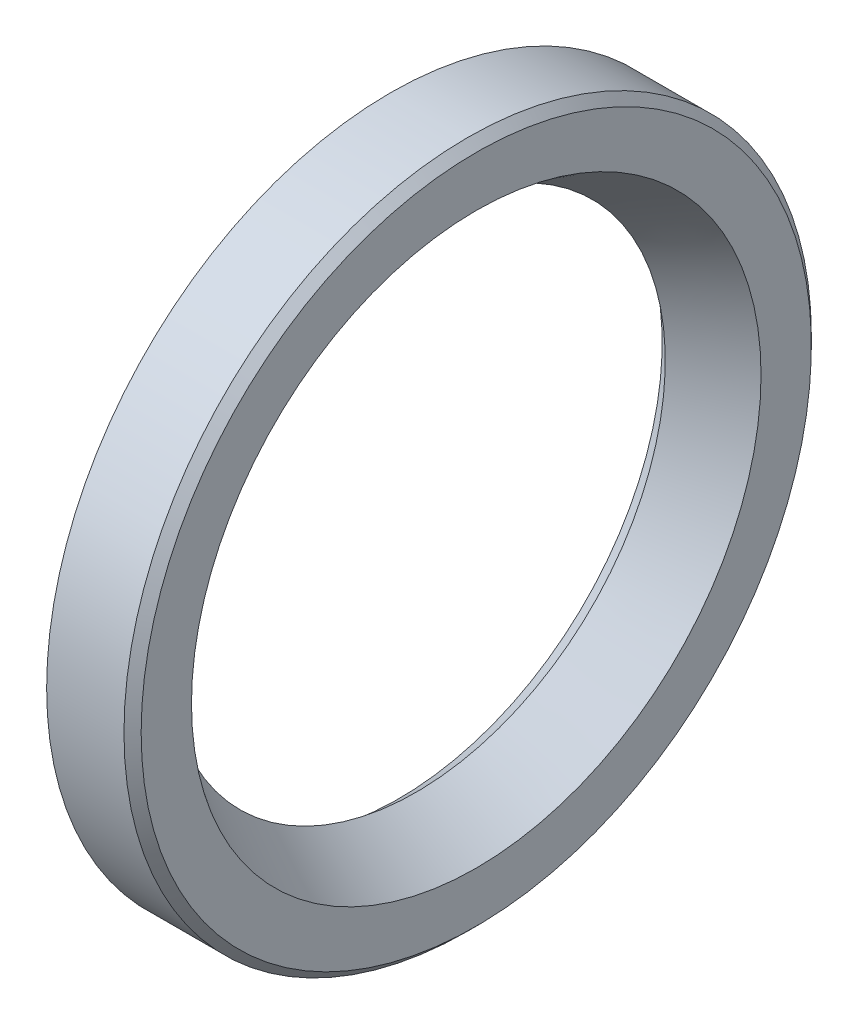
SolidWorks part; units mm, degrees
revolve "Base-Rev" add sketch "Ske" angle 360 about L0
sketch "Ske" plane through (0, 0, 0) normal (0, 0, 1) x (1, 0, 0)
  line L0 (-10, 0) -> (10, 0) construction
  line L1 (2, 33.1429) -> (1, 33.1429)
  line L2 (1, 33.1429) -> (1, 30.6417)
  line L3 (0, 40) -> (9, 40)
  line L4 (10, 33.1429) -> (10, 39)
  line L5 (0, 38.2222) -> (5.6667, 38.2222)
  line L6 (6.6667, 37.2222) -> (6.6667, 33.1429)
  line L7 (5.6667, 32.1429) -> (3, 32.1429)
  line L8 (0, 38.2222) -> (0, 40)
  line L9 (1, 30.6417) -> (3, 29)
  line L10 (3, 29) -> (10, 33.1429)
  line L12 (9, 40) -> (10, 39)
  arc A0 (6.6667, 37.2222) -> (5.6667, 38.2222) centre (5.6667, 37.2222) ccw
  arc A1 (6.6667, 33.1429) -> (5.6667, 32.1429) centre (5.6667, 33.1429) cw
  arc A2 (3, 32.1429) -> (2, 33.1429) centre (3, 33.1429) ccw
  point P1 (10, 40)
ref_plane "Спереди" through (0, 0, 0) normal (0, 0, 1) x (1, 0, 0)
ref_plane "Сверху" through (0, 0, 0) normal (0, 1, 0) x (1, 0, 0)
ref_plane "Справа" through (0, 0, 0) normal (1, 0, 0) x (0, 0, -1)
sketch "Ske2" plane through (0, 0, 0) normal (0, 0, 1) x (1, 0, 0)
  line L0 (10, 33.1429) -> (14, 30.0365)
  line L2 (8.5508, 33.1429) -> (13.8854, 29)
  line L3 (10, 33.1429) -> (8.5508, 33.1429)
  line L4 (13.8854, 29) -> (14, 29.1476)
  line L6 (-1.3061, 0) -> (10, 0) construction
  line L9 (14, 30.0365) -> (14, 29.1476)
  line L10 (1, 33.1429) -> (1, 30.6417) construction
  line L11 (0, 40) -> (0, -40) construction
revolve "Rev1" [suppressed] add sketch "Ske2" angle 360 about L6
equation "\"D4@Ske\" = \"D3@Ske\"/3"
equation "\"D7@Ske\" = \"D3@Ske\"/10"
equation "\"D8@Ske\" = \"D3@Ske\"/10"
equation "\"D10@Ske\" = \"D7@Ske\"*2"
equation "\"D6@Ske\"=(\"D2@Ske\"-\"D11@Ske\")/7"
equation "\"D1@Ske\" = \"D7@Ske\""
equation "\"D1@Ske2\"=\"D5@Ske\"*.5"
equation "\"D3@Ske2\"=\"D1@Ske2\""
